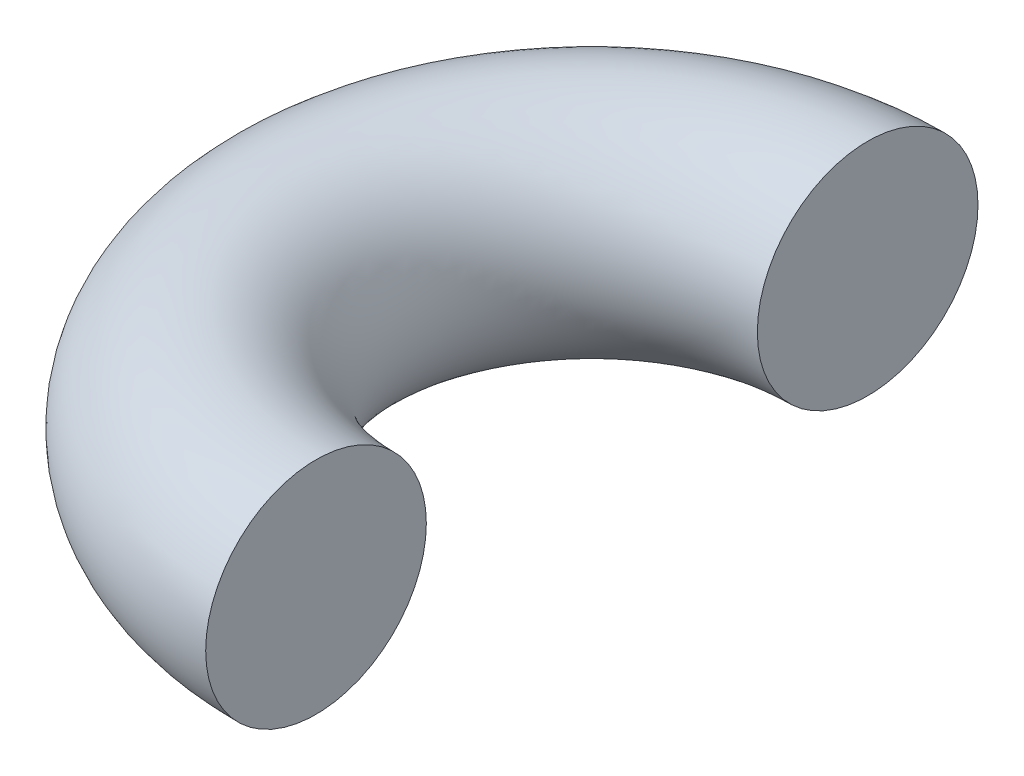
SolidWorks part; units mm, degrees
ref_plane "前视基准面" through (0, 0, 0) normal (0, 0, 1) x (1, 0, 0)
ref_plane "上视基准面" through (0, 0, 0) normal (0, 1, 0) x (1, 0, 0)
ref_plane "右视基准面" through (0, 0, 0) normal (1, 0, 0) x (0, 0, -1)
other "Configuration Table"
sketch "草图2" plane through (0, 0, 0) normal (0, 1, 0) x (1, 0, 0)
  circle A0 centre (0, 0) radius 50
sketch "草图4" plane through (0, 0, 0) normal (0, 0, 1) x (1, 0, 0)
  line L0 (50, 0) -> (-50, 0) construction
  circle A0 centre (50, 0) radius 20
sweep "扫描1" add profiles "草图4" path "草图2"
sketch "草图5" plane through (0, 0, 0) normal (0, 1, 0) x (1, 0, 0)
  line L0 (0, 70) -> (0, -70)
  circle A0 centre (0, 0) radius 70 construction
  arc A1 (0, 70) -> (0, -70) centre (0, 0) cw
extrude "切除-拉伸1" cut sketch "草图5" against normal through all and the other way through all
